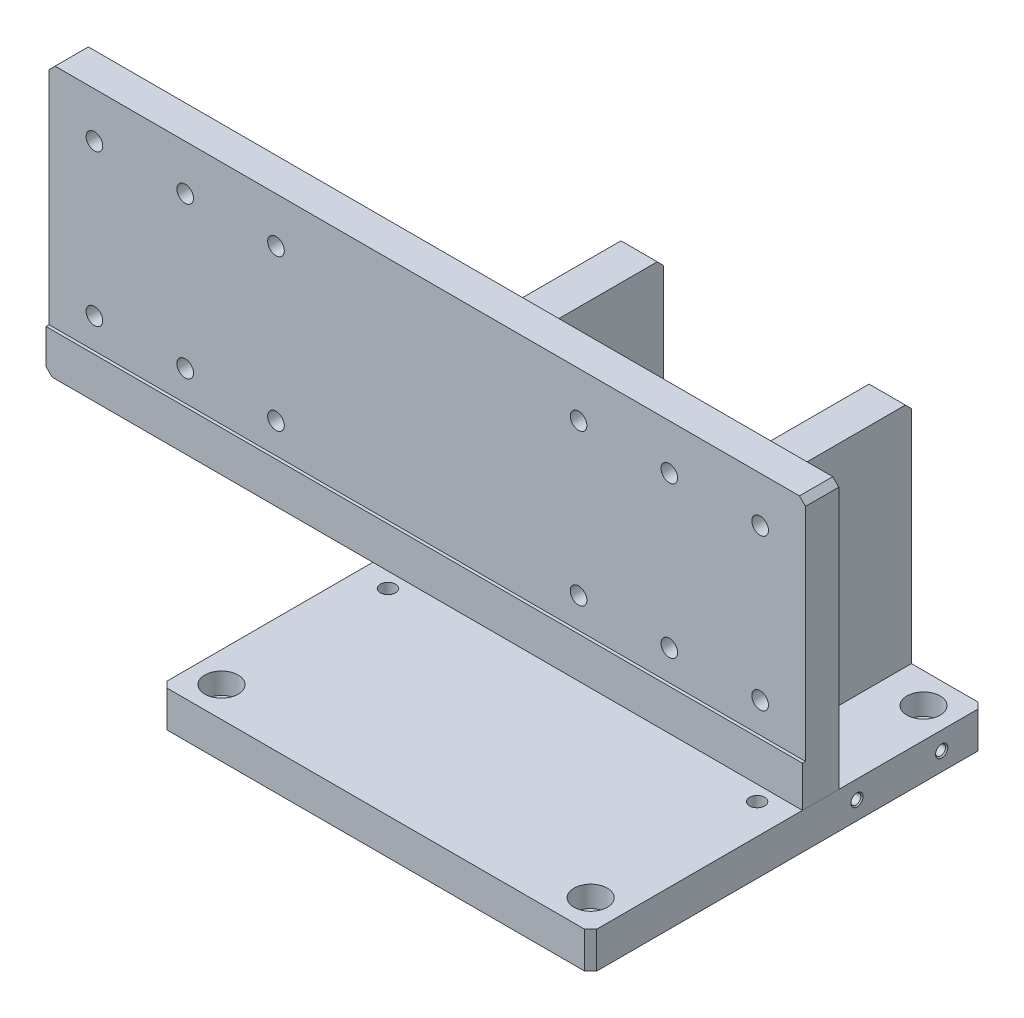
SolidWorks part; units mm, degrees
ref_plane "정면" through (0, 0, 0) normal (0, 0, 1) x (1, 0, 0)
ref_plane "윗면" through (0, 0, 0) normal (0, 1, 0) x (1, 0, 0)
ref_plane "우측면" through (0, 0, 0) normal (1, 0, 0) x (0, 0, -1)
sketch "스케치1" plane through (0, 0, 0) normal (0, 1, 0) x (1, 0, 0)
  line L1 (-71, 65) -> (71, 65)
  line L2 (-71, 65) -> (-71, -65)
  line L3 (-71, -65) -> (71, -65)
  line L4 (71, 65) -> (71, -65)
  line L5 (-71, 65) -> (71, -65) construction
  line L6 (-71, -65) -> (71, 65) construction
  point P0 (0, 0)
  dimension "D1" = 142
  dimension "D2" = 130
extrude "보스-돌출1" add sketch "스케치1" along normal blind 12
sketch "스케치2" plane through (0, 12, 0) normal (0, 1, 0) x (1, 0, 0)
  line L0 (71, -65) -> (71, 65) construction
  line L1 (71, 17) -> (-179, 17)
  line L2 (71, 17) -> (71, 5)
  line L3 (71, 5) -> (-179, 5)
  line L4 (-179, 17) -> (-179, 5)
  line L5 (71, 65) -> (-71, 65) construction
  dimension "D1" = 12
  dimension "D2" = 250
  dimension "D3" = 48
extrude "보스-돌출2" add sketch "스케치2" along normal blind 88.5 separate body
sketch "스케치3" plane through (0, 0, -5) normal (0, 0, 1) x (1, 0, 0)
  line L0 (71, 100.5) -> (71, 12) construction
  line L1 (-179, 100.5) -> (71, 100.5)
  line L2 (-179, 100.5) -> (-179, 25.5)
  line L3 (-179, 25.5) -> (71, 25.5)
  line L4 (71, 100.5) -> (71, 25.5)
  line L5 (-71, 0) -> (71, 0) construction
  dimension "D1" = 25.5
extrude "컷-돌출1" cut sketch "스케치3" against normal blind 1
sketch "스케치4" plane through (0, 12, 0) normal (0, 1, 0) x (1, 0, 0)
  line L0 (71, 65) -> (-71, 65) construction
  line L1 (-47, 65) -> (-35, 65)
  line L2 (-47, 65) -> (-47, 17)
  line L3 (-47, 17) -> (-35, 17)
  line L4 (-35, 65) -> (-35, 17)
  line L5 (71, 17) -> (-179, 17) construction
  line L6 (-71, 65) -> (-71, -65) construction
  line L12 (35, 65) -> (47, 65)
  line L13 (35, 65) -> (35, 17)
  line L14 (35, 17) -> (47, 17)
  line L15 (47, 65) -> (47, 17)
  dimension "D1" = 24
  dimension "D2" = 12
  dimension "D3" = 70
extrude "보스-돌출3" add sketch "스케치4" along normal blind 75 separate body
sketch "스케치5" plane through (-47, 0, 0) normal (-1, 0, 0) x (0, 0, 1)
  line L0 (-65, 87) -> (-65, 85)
  line L1 (-65, 87) -> (-65, 12) construction
  line L2 (-65, 85) -> (-63, 87)
  line L3 (-65, 87) -> (-17, 87) construction
  line L4 (-63, 87) -> (-65, 87)
  dimension "D1" = 2
  dimension "D2" = 2
extrude "컷-돌출2" cut sketch "스케치5" against normal through all
hole_wizard "M6 소켓 머리 캡 나사용 카운터보어1" positions "스케치6" profile "스케치7" counterbore size "M6" standard "KS"
sketch "스케치6" plane through (0, 12, 0) normal (0, 1, 0) x (1, 0, 0)
  line L0 (-71, -65) -> (71, -65) construction
  line L1 (71, -65) -> (71, 65) construction
  point P0 (-61, 55)
  point P2 (61, 55)
  point P4 (-61, -55)
  point P6 (61, -55)
  dimension "D1" = 110
  dimension "D2" = 10
  dimension "D3" = 10
  dimension "D4" = 122
sketch "스케치7" plane through (-61, 12, -55) normal (1, 0, 0) x (0, 0, 1)
  line L0 (0, 0) -> (0, 12)
  line L1 (0, 12) -> (3.3, 12)
  line L3 (3.3, 12) -> (3.3, 7)
  line L4 (3.3, 7) -> (5.5, 7)
  line L5 (5.5, 7) -> (5.5, 0)
  line L7 (5.5, 0) -> (0, 0)
  line L11 (0, -6.35) -> (0, 107.95) construction
  dimension "관통 구멍 지름" = 6.6
  dimension "관통 구멍 깊이" = 12
  dimension "카운터보어 지름" = 11
  dimension "카운터보어 깊이" = 7
hole_wizard "Ø5.0mm 맞춤핀 구멍1" positions "스케치8" profile "스케치9" hole size "Ø5.0" standard "ISO"
sketch "스케치8" plane through (0, 12, 0) normal (0, 1, 0) x (1, 0, 0)
  line L0 (0, 0) -> (111.4718, 0) construction
  line L1 (71, -65) -> (71, 65) construction
  point P5 (61, 0)
  point P7 (-61, 0)
  dimension "D1" = 10
  dimension "D2" = 122
sketch "스케치9" plane through (-61, 12, 0) normal (1, 0, 0) x (0, 0, 1)
  line L0 (0, 0) -> (0, 12)
  line L1 (0, 12) -> (2.5, 12)
  line L2 (2.5, 12) -> (2.5, 0)
  line L5 (2.5, 0) -> (0, 0)
  line L11 (0, -6.35) -> (0, 107.95) construction
  dimension "관통 구멍 지름" = 5
  dimension "관통 구멍 깊이" = 12
hole_wizard "M4 나사 구멍1" positions "스케치12" profile "스케치13" tap size "M4" standard "ISO"
sketch "스케치12" plane through (71, 0, 0) normal (1, 0, 0) x (0, 0, -1)
  line L0 (65, 12) -> (65, 0) construction
  line L2 (-65, 0) -> (65, 0) construction
  point P0 (51, 6)
  point P2 (23, 6)
  dimension "D1" = 14
  dimension "D2" = 28
  dimension "D3" = 6
sketch "스케치13" plane through (71, 6, -51) normal (0, 1, 0) x (0, 0, -1)
  line L0 (0, 0) -> (0, 4.9914)
  line L1 (0, 4.9914) -> (1.65, 4)
  line L2 (1.65, 4) -> (1.65, 0.375)
  line L3 (1.65, 0.375) -> (2.025, 0)
  line L5 (2.025, 0) -> (0, 0)
  line L6 (-1.65, 0.375) -> (-2.025, 0) construction
  line L10 (0, 4.9914) -> (-1.65, 4) construction
  line L11 (0, -6.35) -> (0, 107.95) construction
  dimension "탭 드릴 지름" = 3.3
  dimension "탭 드릴 깊이" = 4
  dimension "표면 카운터싱크 지름" = 4.05
  dimension "표면 카운터싱크 각도" = 90
  dimension "드릴 각도" = 118
hole_wizard "M5 소켓 머리 캡 나사용 카운터보어1" positions "스케치14" profile "스케치15" counterbore size "M5" standard "KS"
sketch "스케치14" plane through (0, 0, -17) normal (0, 0, -1) x (-1, 0, 0)
  line L0 (-71, 100.5) -> (-71, 12) construction
  line L1 (-71, 100.5) -> (179, 100.5) construction
  point P0 (-56, 85.5)
  point P2 (-26, 85.5)
  point P4 (4, 85.5)
  point P6 (-56, 35.5)
  point P8 (-26, 35.5)
  point P10 (4, 35.5)
  dimension "D1" = 15
  dimension "D2" = 30
  dimension "D3" = 30
  dimension "D4" = 15
  dimension "D5" = 50
sketch "스케치15" plane through (56, 85.5, -17) normal (1, 0, 0) x (0, 1, 0)
  line L0 (0, 0) -> (0, 82)
  line L1 (0, 82) -> (2.75, 82)
  line L3 (2.75, 82) -> (2.75, 6)
  line L4 (2.75, 6) -> (4.75, 6)
  line L5 (4.75, 6) -> (4.75, 0)
  line L7 (4.75, 0) -> (0, 0)
  line L11 (0, -6.35) -> (0, 107.95) construction
  dimension "관통 구멍 지름" = 5.5
  dimension "관통 구멍 깊이" = 82
  dimension "카운터보어 지름" = 9.5
  dimension "카운터보어 깊이" = 6
pattern_linear "선형 패턴1" count 2 spacing 160 along (-1, 0, 0) of "M5 소켓 머리 캡 나사용 카운터보어1"
chamfer "모따기1" distance 2 angle 45 3 edges at (-179, 12, -11) (71, 100.5, -11.5) (-179, 100.5, -11.5)
chamfer "모따기2" distance 2 angle 45 4 edges at (-71, 6, -65) (71, 6, -65) (-71, 6, 65) (71, 6, 65)
